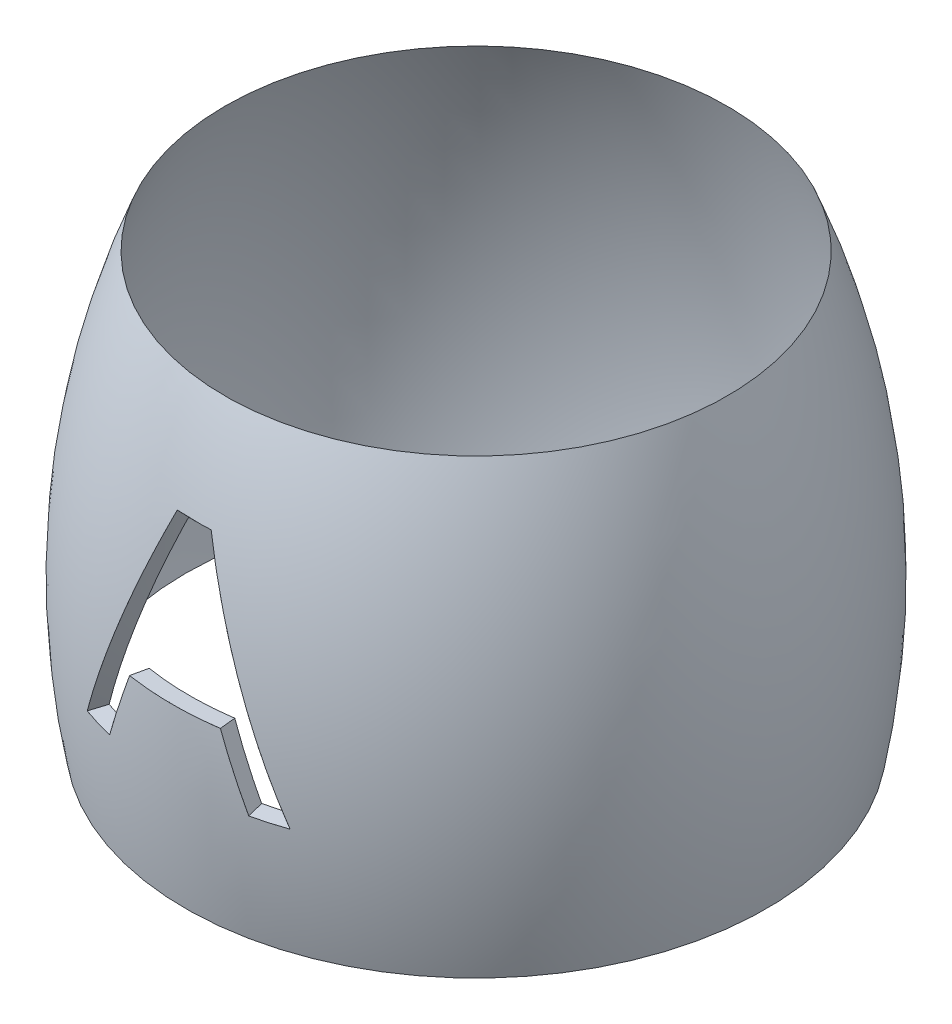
SolidWorks part; units mm, degrees
ref_plane "Front Plane" through (0, 0, 0) normal (0, 0, 1) x (1, 0, 0)
ref_plane "Top Plane" through (0, 0, 0) normal (0, 1, 0) x (1, 0, 0)
ref_plane "Right Plane" through (0, 0, 0) normal (1, 0, 0) x (0, 0, -1)
sketch "Sketch3" plane through (0, 0, 0) normal (0, 0, 1) x (1, 0, 0)
  line L0 (385.524, 64.9627) -> (385.524, -98.5118)
  line L1 (385.524, 64.9627) -> (405.1122, 64.9627)
  line L2 (385.524, -98.5118) -> (471.7802, -98.5118)
  arc A0 (405.1122, 64.9627) -> (460.0961, 27.4884) centre (405.1122, 5.8882) cw
  arc A1 (460.0961, 27.4884) -> (471.7802, -98.5118) centre (248.3704, -55.6869) cw
revolve "Revolve1" add sketch "Sketch3" angle 360 about L0
ref_plane "Plane2" through (0, 0, 96.52) normal (0, 0, 1) x (1, 0, 0)
surface "Surface-Offset2" parameters "D1"=2.54
sketch "Sketch4" plane through (0, 0, 96.52) normal (0, 0, 1) x (1, 0, 0)
  line L0 (295.342, -63.7133) -> (475.706, -63.7133) construction
  arc A0 (310.9519, 27.4884) -> (299.2678, -98.5118) centre (522.6776, -55.6869) ccw construction
  arc A1 (471.7802, -98.5118) -> (460.0961, 27.4884) centre (248.3704, -55.6869) ccw construction
  text T0 "A" font "Arial" height 63.5
extrude "Cut-Extrude1" cut sketch "Sketch4" against normal up to surface (10.1491 mm away)
surface "Surface-Offset3" parameters "D1"=0
other "Ruled Surface1" parameters "D1"=5.08, "D2"=37
